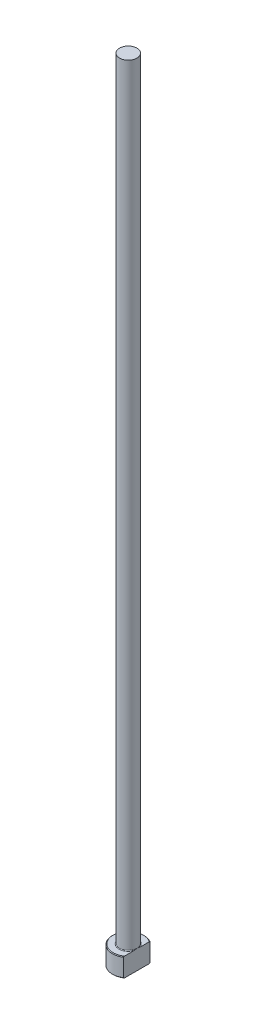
SolidWorks part; units mm, degrees
ref_plane "Front Plane" through (0, 0, 0) normal (0, 0, 1) x (1, 0, 0)
ref_plane "Top Plane" through (0, 0, 0) normal (0, 1, 0) x (1, 0, 0)
ref_plane "Right Plane" through (0, 0, 0) normal (1, 0, 0) x (0, 0, -1)
sketch "Sketch1" plane through (0, 0, 0) normal (0, 0, 1) x (1, 0, 0)
  line L0 (0, 259.9588) -> (0, -15.1925) construction
  line L1 (0, 0) -> (-5, 0)
  line L2 (-5, 0) -> (-5, 6)
  line L3 (-5, 6) -> (-2.75, 6)
  line L4 (-2.75, 6) -> (-2.75, 250)
  line L5 (-2.75, 250) -> (0, 250)
  line L6 (0, 250) -> (0, 0)
  dimension "L" = 250
  dimension "H" = 10
  dimension "T" = 6
  dimension "D" = 5.5
revolve "Revolve1" add sketch "Sketch1" angle 360 about L0
chamfer "Chamfer1" distance 0.2 angle 45 2 edges at (0, 6, 5) (0, 0, 5)
fillet "Fillet1" radius 0.2 1 edges at (0, 6, 2.75)
sketch "Sketch2" plane through (0, 0, 0) normal (0, 1, 0) x (1, 0, 0)
  line L0 (2.75, -4.1758) -> (2.75, 4.1758)
  circle A0 centre (0, 0) radius 5 construction
  arc A1 (2.75, -4.1758) -> (2.75, 4.1758) centre (0, 0) ccw
  circle A2 centre (0, 0) radius 2.75 construction
extrude "KEYED HEAD" cut sketch "Sketch2" along normal through all
